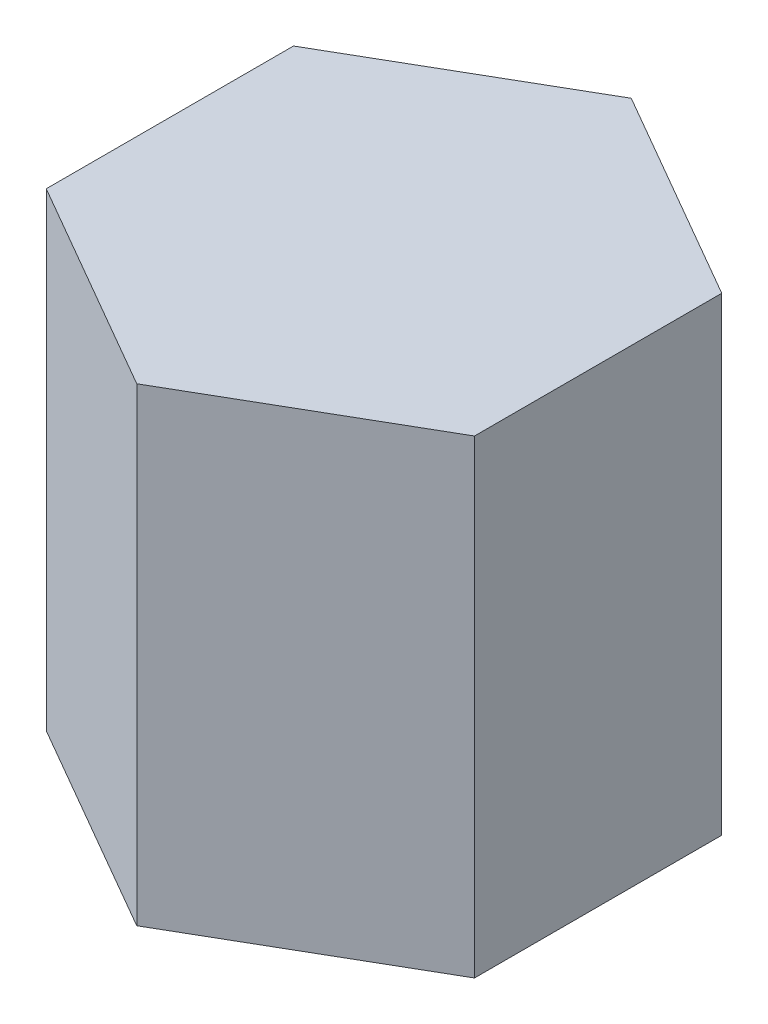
SolidWorks part; units mm, degrees
ref_plane "前视基准面" through (0, 0, 0) normal (0, 0, 1) x (1, 0, 0)
ref_plane "上视基准面" through (0, 0, 0) normal (0, 1, 0) x (1, 0, 0)
ref_plane "右视基准面" through (0, 0, 0) normal (1, 0, 0) x (0, 0, -1)
sketch "草图1" plane through (0, 0, 0) normal (0, 1, 0) x (1, 0, 0)
  line L1 (0, 57.9424) -> (-50.1796, 28.9712)
  line L2 (-50.1796, 28.9712) -> (-50.1796, -28.9712)
  line L3 (-50.1796, -28.9712) -> (0, -57.9424)
  line L4 (0, -57.9424) -> (50.1796, -28.9712)
  line L5 (50.1796, -28.9712) -> (50.1796, 28.9712)
  line L6 (50.1796, 28.9712) -> (0, 57.9424)
  circle A0 centre (0, 0) radius 50.1796 construction
extrude "凸台-拉伸1" add sketch "草图1" along normal blind 110
